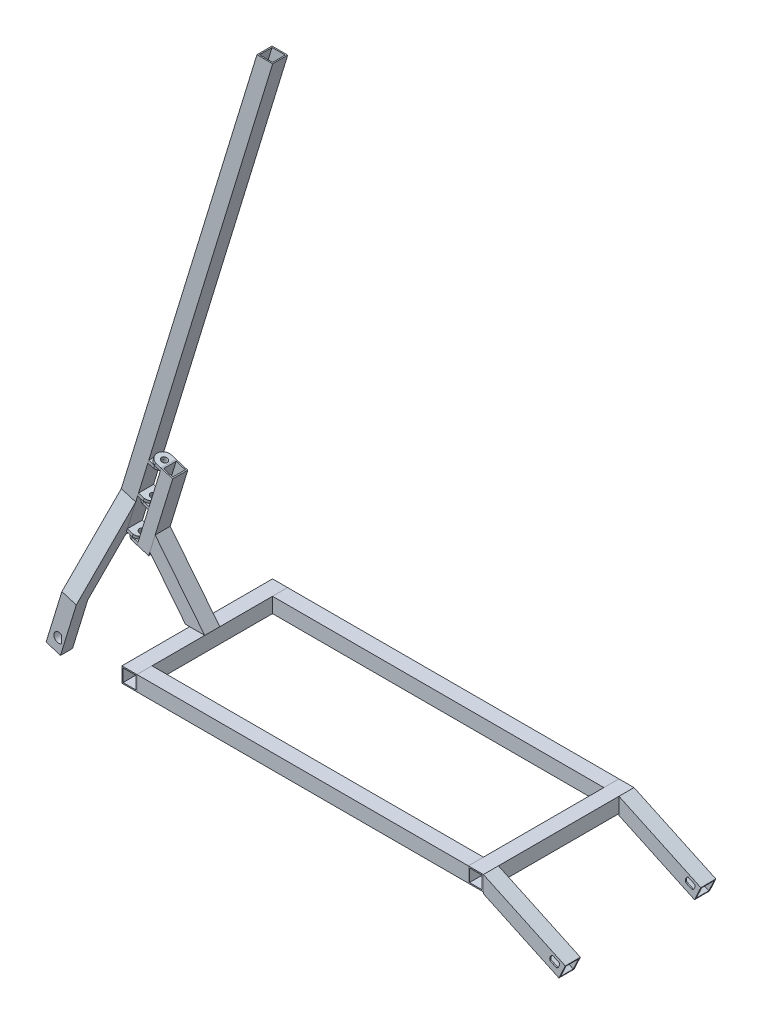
SolidWorks part; units mm, degrees
ref_plane "Front Plane" through (0, 0, 0) normal (0, 0, 1) x (1, 0, 0)
ref_plane "Top Plane" through (0, 0, 0) normal (0, 1, 0) x (1, 0, 0)
ref_plane "Right Plane" through (0, 0, 0) normal (1, 0, 0) x (0, 0, -1)
sketch "Sketch1" plane through (0, 0, 0) normal (1, 0, 0) x (0, 0, -1)
  line L0 (-108.6365, 0) -> (108.6365, 0) construction
  line L1 (0, 62.9912) -> (0, -62.9912) construction
  line L2 (-123, 10.5) -> (-123, -10.5)
  line L3 (-125, 12.5) -> (-100, 12.5)
  line L4 (-125, 12.5) -> (-125, -12.5)
  line L5 (-125, -12.5) -> (-100, -12.5)
  line L6 (-100, 12.5) -> (-100, -12.5)
  line L7 (-125, 12.5) -> (-100, -12.5) construction
  line L8 (-125, -12.5) -> (-100, 12.5) construction
  line L9 (-123, -10.5) -> (-102, -10.5)
  line L10 (-102, 10.5) -> (-102, -10.5)
  line L11 (-123, 10.5) -> (-102, 10.5)
  line L12 (125, -12.5) -> (100, -12.5)
  line L13 (123, -10.5) -> (102, -10.5)
  line L14 (102, 10.5) -> (102, -10.5)
  line L15 (100, 12.5) -> (100, -12.5)
  line L16 (125, 12.5) -> (125, -12.5)
  line L17 (123, 10.5) -> (123, -10.5)
  line L18 (123, 10.5) -> (102, 10.5)
  line L19 (125, 12.5) -> (100, 12.5)
  point P5 (-112.5, 0)
extrude "Boss-Extrude1" add sketch "Sketch1" along normal blind 550
sketch "Sketch2" plane through (0, 0, -125) normal (0, 0, -1) x (-1, 0, 0)
  line L0 (0, -12.5) -> (0, 12.5) construction
  line L1 (0, 12.5) -> (25, 12.5)
  line L2 (0, 12.5) -> (0, -12.5)
  line L3 (0, -12.5) -> (25, -12.5)
  line L4 (25, 12.5) -> (25, -12.5)
  line L5 (2, 10.5) -> (2, -10.5)
  line L6 (2, -10.5) -> (23, -10.5)
  line L7 (23, 10.5) -> (23, -10.5)
  line L8 (2, 10.5) -> (23, 10.5)
  dimension "D1" = 2
extrude "Boss-Extrude2" add sketch "Sketch2" against normal up to surface (250 mm away) separate body
sketch "Sketch3" plane through (0, 0, 125) normal (0, 0, 1) x (1, 0, 0)
  line L0 (550, 12.5) -> (550, -12.5) construction
  line L1 (550, 12.5) -> (575, 12.5)
  line L2 (550, 12.5) -> (550, -12.5)
  line L3 (550, -12.5) -> (575, -12.5)
  line L4 (575, 12.5) -> (575, -12.5)
  line L5 (552, 10.5) -> (552, -10.5)
  line L6 (552, -10.5) -> (573, -10.5)
  line L7 (573, 10.5) -> (573, -10.5)
  line L8 (552, 10.5) -> (573, 10.5)
  dimension "D1" = 2
extrude "Boss-Extrude3" add sketch "Sketch3" against normal up to surface (250 mm away) separate body
sketch "Sketch4" plane through (0, 0, 125) normal (0, 0, 1) x (1, 0, 0)
  line L0 (575, 12.5) -> (575, -15.0844)
  line L1 (575, -15.0844) -> (700.3807, -73.5504)
  line L2 (700.3807, -73.5504) -> (710.9462, -50.8927)
  line L3 (710.9462, -50.8927) -> (575, 12.5)
  line L5 (550, 12.5) -> (0, 12.5) construction
extrude "Boss-Extrude4" add sketch "Sketch4" against normal blind 25 separate body
sketch "Sketch5" plane through (603.4598, -281.3979, 0) normal (0.9063, -0.4226, 0) x (0, 0, -1)
  line L8 (-123, 252.3343) -> (-123, 231.3343)
  line L9 (-123, 231.3343) -> (-102, 231.3343)
  line L10 (-102, 231.3343) -> (-102, 252.3343)
  line L11 (-102, 252.3343) -> (-123, 252.3343)
  line L12 (-123, 252.3343) -> (-123, 231.3343)
  line L13 (-123, 231.3343) -> (-102, 231.3343)
  line L14 (-102, 231.3343) -> (-102, 252.3343)
  line L15 (-102, 252.3343) -> (-123, 252.3343)
  dimension "D1" = 2
extrude "Cut-Extrude1" cut sketch "Sketch5" against normal up to surface (139.2749 mm away)
mirror "Mirror2" about plane through (0, 0, 0) normal (0, 0, 1)
sketch "Sketch7" plane through (0, 0, -125) normal (0, 0, -1) x (-1, 0, 0)
  line L0 (-705.6634, -62.2216) -> (-581.554, 22.9564) construction
  line L1 (-700.3807, -73.5504) -> (-710.9462, -50.8927) construction
  line L2 (-700.7995, -51.3565) -> (-689.9238, -46.2851)
  line L3 (-696.3269, -60.948) -> (-685.4512, -55.8766)
  line L4 (-710.9462, -50.8927) -> (-575, 12.5) construction
  line L5 (-575, -15.0844) -> (-700.3807, -73.5504) construction
  arc A0 (-700.7995, -51.3565) -> (-696.3269, -60.948) centre (-693.1254, -53.6165) ccw
  arc A1 (-685.4512, -55.8766) -> (-689.9238, -46.2851) centre (-693.1254, -53.6165) ccw
  dimension "D1" = 16
  dimension "D4" = 10.583
  dimension "D2" = 15
  dimension "D3" = 12
  dimension "D5" = 10
  dimension "D6" = 10.1467
extrude "Cut-Extrude2" cut sketch "Sketch7" against normal up to surface (250 mm away)
sketch "Sketch8" plane through (0, 0, 0) normal (0, 0, 1) x (1, 0, 0)
  line L0 (-187.3124, -56.8299) -> (96.2881, 870.7857) construction
  line L1 (-187.3124, -56.8299) -> (-187.3124, 928.9233) construction
  line L2 (0, 12.5) -> (-112.5251, 153.5854)
  line L3 (0, 12.5) -> (-31.9777, 12.5)
  line L4 (-31.9777, 12.5) -> (-121.3863, 124.6017)
  line L5 (-147.026, 40.738) -> (-104.289, 180.5245) construction
  line L6 (-112.5251, 153.5854) -> (-121.3863, 124.6017)
extrude "Boss-Extrude5" add sketch "Sketch8" along normal blind 12.5 and the other way blind 12.5 separate body
sketch "Sketch9" plane through (0, 0, 0) normal (0, 0, 1) x (1, 0, 0)
  line L0 (-131.3513, 92.0075) -> (-155.259, 99.3168)
  line L1 (-147.026, 40.738) -> (-104.289, 180.5245) construction
  line L2 (-155.259, 99.3168) -> (86.6367, 890.522)
  line L3 (86.6367, 890.522) -> (112.779, 890.522)
  line L4 (112.779, 890.522) -> (-131.3513, 92.0075)
  line L5 (-187.3124, -56.8299) -> (96.2881, 870.7857) construction
extrude "Boss-Extrude6" add sketch "Sketch9" along normal up to surface and the other way up to surface separate body
sketch "Sketch10" plane through (14.4969, 47.4173, 0) normal (-0.2924, -0.9563, 0) x (0.9563, -0.2924, 0)
  line L8 (-154.5123, 10.5) -> (-175.5123, 10.5)
  line L9 (-175.5123, 10.5) -> (-175.5123, -10.5)
  line L10 (-175.5123, -10.5) -> (-154.5123, -10.5)
  line L11 (-154.5123, -10.5) -> (-154.5123, 10.5)
  line L12 (-154.5123, 10.5) -> (-175.5123, 10.5)
  line L13 (-175.5123, 10.5) -> (-175.5123, -10.5)
  line L14 (-175.5123, -10.5) -> (-154.5123, -10.5)
  line L15 (-154.5123, -10.5) -> (-154.5123, 10.5)
  dimension "D1" = 2
extrude "Cut-Extrude3" cut sketch "Sketch10" against normal up to surface (827.9682 mm away)
sketch "Sketch11" plane through (-169.7559, 51.8996, 0) normal (-0.9563, 0.2924, 0) x (0, 0, 1)
  line L0 (12.5, 49.5838) -> (47.7141, -45.1849)
  line L1 (47.7141, -45.1849) -> (47.7141, -131.1622)
  line L2 (47.7141, -131.1622) -> (67.7141, -131.1622)
  line L3 (67.7141, -131.1622) -> (67.7141, -41.5892)
  line L4 (67.7141, -41.5892) -> (12.5, 107.0039)
  line L5 (12.5, 83.6673) -> (12.5, 2.6044) construction
  line L6 (12.5, 107.0039) -> (12.5, 49.5838)
  dimension "D1" = 20
  dimension "D2" = 20
extrude "Boss-Extrude7" add sketch "Sketch11" against normal up to surface (25 mm away) separate body
sketch "Sketch12" plane through (0, 0, 12.5) normal (0, 0, 1) x (1, 0, 0)
  line L0 (-121.3863, 124.6017) -> (-112.5251, 153.5854)
  line L1 (-121.3863, 124.6017) -> (-91.1493, 86.6902)
  line L2 (-31.9777, 12.5) -> (-121.3863, 124.6017) construction
  line L3 (-91.1493, 86.6902) -> (-82.2881, 115.6739)
  line L4 (0, 12.5) -> (-112.5251, 153.5854) construction
  line L5 (-82.2881, 115.6739) -> (-112.5251, 153.5854)
  point P10 (-97.4066, 134.6297)
  dimension "D1" = 20
  dimension "D2" = 20
extrude "Cut-Extrude4" cut sketch "Sketch12" against normal up to surface (25 mm away)
sketch "Sketch14" plane through (-107.5961, 32.8954, 0) normal (-0.9563, 0.2924, 0) x (0, 0, 1)
  line L1 (-12.5, 49.5838) -> (12.5, 49.5838)
  line L2 (-12.5, 49.5838) -> (-12.5, 186.1757)
  line L3 (-12.5, 186.1757) -> (12.5, 186.1757)
  line L4 (12.5, 49.5838) -> (12.5, 186.1757)
  line L5 (12.5, 876.9406) -> (12.5, 49.5838) construction
  line L11 (12.5, 49.5838) -> (-12.5, 49.5838) construction
extrude "Boss-Extrude8" add sketch "Sketch14" along normal blind 20 separate body
sketch "Sketch15" plane through (54.4325, 178.0407, 0) normal (0.2924, 0.9563, 0) x (0.9563, -0.2924, 0)
  line L8 (-114.5123, -10.5) -> (-114.5123, 10.5)
  line L9 (-114.5123, 10.5) -> (-130.5123, 10.5)
  line L10 (-130.5123, 10.5) -> (-130.5123, -10.5)
  line L11 (-130.5123, -10.5) -> (-114.5123, -10.5)
  line L12 (-114.5123, -10.5) -> (-114.5123, 10.5)
  line L13 (-114.5123, 10.5) -> (-130.5123, 10.5)
  line L14 (-130.5123, 10.5) -> (-130.5123, -10.5)
  line L15 (-130.5123, -10.5) -> (-114.5123, -10.5)
  dimension "D1" = 2
extrude "Cut-Extrude5" cut sketch "Sketch15" against normal up to surface (136.5918 mm away)
sketch "Sketch16" plane through (0, 0, 67.7141) normal (0, 0, 1) x (1, 0, 0)
  line L0 (-182.3124, -50.5849) -> (-182.3124, -63.0749)
  line L1 (-182.3124, -63.0749) -> (-182.3124, -50.5849) construction
  arc A0 (-182.3124, -50.5849) -> (-182.3124, -63.0749) centre (-187.3124, -56.8299) ccw
extrude "Cut-Extrude6" cut sketch "Sketch16" against normal up to surface (20 mm away)
sketch "Sketch17" plane through (54.4325, 178.0407, 0) normal (0.2924, 0.9563, 0) x (0.9563, -0.2924, 0)
  line L0 (-132.5123, 12.5) -> (-132.5123, -12.5)
  line L1 (-132.5123, -12.5) -> (-142.5123, -12.5)
  line L2 (-132.5123, 12.5) -> (-142.5123, 12.5)
  line L3 (-152.5123, -12.5) -> (-152.5123, 12.5) construction
  arc A0 (-142.5123, 12.5) -> (-142.5123, -12.5) centre (-139.6998, 0) ccw
  circle A1 centre (-139.6998, 0) radius 5
  dimension "D2" = 10
  dimension "D1" = 10
extrude "Boss-Extrude9" add sketch "Sketch17" against normal blind 5 separate body
sketch "Sketch18" plane through (14.4969, 47.4173, 0) normal (-0.2924, -0.9563, 0) x (0.9563, -0.2924, 0)
  line L3 (-142.5123, -12.5) -> (-132.5123, -12.5)
  line L4 (-112.5123, -12.5) -> (-112.5123, 12.5)
  line L5 (-112.5123, 12.5) -> (-132.5123, 12.5)
  line L6 (-132.5123, 12.5) -> (-132.5123, -12.5)
  line L7 (-132.5123, -12.5) -> (-112.5123, -12.5)
  line L8 (-112.5123, -12.5) -> (-112.5123, 12.5)
  line L9 (-112.5123, 12.5) -> (-132.5123, 12.5)
  line L10 (-132.5123, 12.5) -> (-132.5123, -12.5)
  line L11 (-132.5123, -12.5) -> (-112.5123, -12.5)
  line L12 (-132.5123, -12.5) -> (-132.5123, 12.5)
  line L13 (-132.5123, 12.5) -> (-142.5123, 12.5)
  line L14 (-142.5123, -12.5) -> (-132.5123, -12.5)
  line L15 (-132.5123, -12.5) -> (-132.5123, 12.5)
  line L16 (-132.5123, 12.5) -> (-142.5123, 12.5)
  circle A0 centre (-139.6998, 0) radius 5 construction
  arc A1 (-142.5123, 12.5) -> (-142.5123, -12.5) centre (-139.6998, 0) ccw
  arc A2 (-142.5123, 12.5) -> (-142.5123, -12.5) centre (-139.6998, 0) ccw
  circle A3 centre (-139.6998, 0) radius 5
  dimension "D1" = 0
  dimension "D2" = 0
extrude "Boss-Extrude10" add sketch "Sketch18" against normal blind 5 separate body contours L16 A2 L14 L15 | A3
ref_plane "Plane1" through (34.4647, 112.729, 0) normal (-0.2924, -0.9563, 0) x (-0.9563, 0.2924, 0)
sketch "Sketch19" plane through (34.4647, 112.729, 0) normal (-0.2924, -0.9563, 0) x (-0.9563, 0.2924, 0)
  line L3 (132.5123, 12.5) -> (132.5123, -12.5)
  line L4 (132.5123, -12.5) -> (142.5123, -12.5)
  line L5 (142.5123, 12.5) -> (132.5123, 12.5)
  line L6 (132.5123, 12.5) -> (132.5123, -12.5)
  line L7 (132.5123, -12.5) -> (142.5123, -12.5)
  line L8 (142.5123, 12.5) -> (132.5123, 12.5)
  circle A0 centre (139.6998, 0) radius 5 construction
  arc A1 (142.5123, -12.5) -> (142.5123, 12.5) centre (139.6998, 0) ccw
  arc A2 (142.5123, -12.5) -> (142.5123, 12.5) centre (139.6998, 0) ccw
  circle A3 centre (139.6998, 0) radius 5
  dimension "D1" = 0
extrude "Boss-Extrude11" add sketch "Sketch19" along normal blind 5 separate body
sketch "Sketch20" plane through (52.9706, 173.2592, 0) normal (-0.2924, -0.9563, 0) x (0.9563, -0.2924, 0)
  line L0 (-152.5123, 12.5) -> (-152.5123, -12.5)
  line L1 (-152.5123, -12.5) -> (-142.5123, -12.5)
  line L2 (-142.5123, -12.5) -> (-132.5123, -12.5) construction
  line L3 (-152.5123, 12.5) -> (-142.5123, 12.5)
  line L4 (-132.5123, 12.5) -> (-142.5123, 12.5) construction
  line L5 (-132.5123, -12.5) -> (-132.5123, 12.5) construction
  arc A0 (-142.5123, -12.5) -> (-142.5123, 12.5) centre (-145.3248, 0) ccw
  circle A1 centre (-139.6998, 0) radius 5 construction
  circle A2 centre (-139.6998, 0) radius 5
  point P13 (0, 0)
  dimension "D1" = 10
extrude "Boss-Extrude12" add sketch "Sketch20" along normal blind 5 separate body
sketch "Sketch21" plane through (34.4647, 112.729, 0) normal (0.2924, 0.9563, 0) x (0.9563, -0.2924, 0)
  line L3 (-152.5123, -12.5) -> (-142.5123, -12.5)
  line L4 (-152.5123, 12.5) -> (-152.5123, -12.5)
  line L5 (-142.5123, 12.5) -> (-152.5123, 12.5)
  line L6 (-152.5123, -12.5) -> (-142.5123, -12.5)
  line L7 (-152.5123, 12.5) -> (-152.5123, -12.5)
  line L8 (-142.5123, 12.5) -> (-152.5123, 12.5)
  circle A0 centre (-139.6998, 0) radius 5 construction
  arc A1 (-142.5123, -12.5) -> (-142.5123, 12.5) centre (-145.3248, 0) ccw
  arc A2 (-142.5123, -12.5) -> (-142.5123, 12.5) centre (-145.3248, 0) ccw
  circle A3 centre (-139.6998, 0) radius 5
  dimension "D1" = 0
extrude "Boss-Extrude13" add sketch "Sketch21" along normal blind 5 separate body
sketch "Sketch22" plane through (15.9588, 52.1988, 0) normal (0.2924, 0.9563, 0) x (0.9563, -0.2924, 0)
  line L3 (-142.5123, 12.5) -> (-152.5123, 12.5)
  line L4 (-152.5123, 12.5) -> (-152.5123, -12.5)
  line L5 (-152.5123, -12.5) -> (-142.5123, -12.5)
  line L6 (-142.5123, 12.5) -> (-152.5123, 12.5)
  line L7 (-152.5123, 12.5) -> (-152.5123, -12.5)
  line L8 (-152.5123, -12.5) -> (-142.5123, -12.5)
  circle A0 centre (-139.6998, 0) radius 5 construction
  arc A1 (-142.5123, -12.5) -> (-142.5123, 12.5) centre (-145.3248, 0) ccw
  arc A2 (-142.5123, -12.5) -> (-142.5123, 12.5) centre (-145.3248, 0) ccw
  circle A3 centre (-139.6998, 0) radius 5
  dimension "D1" = 0
extrude "Boss-Extrude14" add sketch "Sketch22" along normal blind 5 separate body
equation "\"lenght\" = 550"
equation "\"middle space member\" = 250"
equation "\"sqrTube_Lenght\" = 25"
equation "\"D1@Sketch1\"=\"sqrTube_Lenght\""
equation "\"sqrTube_thickness\"= 2"
equation "\"D3@Sketch1\"=250/2"
equation "\"D1@Boss-Extrude1\"=\"lenght\""
equation "\"D2@Sketch4\"=\"sqrTube_Lenght\""
equation "\"D1@Boss-Extrude4\"=\"sqrTube_Lenght\""
equation "\"D2@Sketch8\"=\"sqrTube_Lenght\""
equation "\"D1@Boss-Extrude5\"=\"sqrTube_Lenght\"/2"
equation "\"D2@Boss-Extrude5\"=\"sqrTube_Lenght\"/2"
equation "\"D1@Sketch9\"=\"sqrTube_Lenght\""
